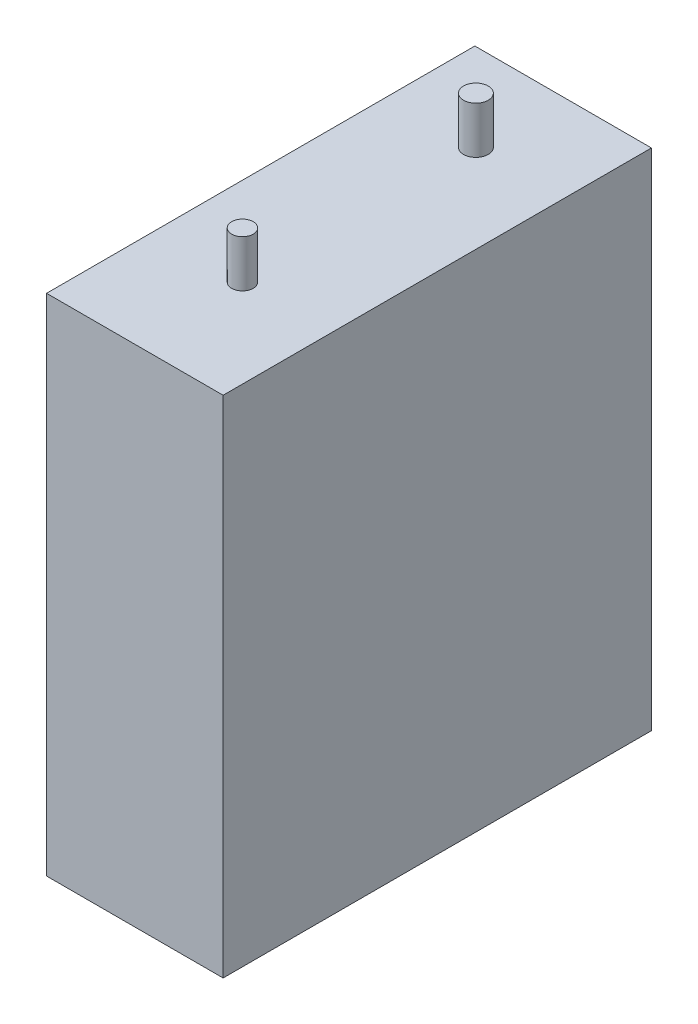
SolidWorks part; units mm, degrees
ref_plane "Front Plane" through (0, 0, 0) normal (0, 0, 1) x (1, 0, 0)
ref_plane "Top Plane" through (0, 0, 0) normal (0, 1, 0) x (1, 0, 0)
ref_plane "Right Plane" through (0, 0, 0) normal (1, 0, 0) x (0, 0, -1)
sketch "Sketch1" plane through (0, 0, 0) normal (1, 0, 0) x (0, 0, -1)
  line L1 (-86.868, -102.362) -> (86.868, -102.362)
  line L2 (-86.868, -102.362) -> (-86.868, 102.362)
  line L3 (-86.868, 102.362) -> (86.868, 102.362)
  line L4 (86.868, -102.362) -> (86.868, 102.362)
  line L5 (-86.868, -102.362) -> (86.868, 102.362) construction
  line L6 (-86.868, 102.362) -> (86.868, -102.362) construction
  point P0 (0, 0)
  dimension "D1" = 204.724
  dimension "D2" = 173.736
extrude "Boss-Extrude1" add sketch "Sketch1" along normal mid plane 71.628
sketch "Sketch2" plane through (0, 102.362, 0) normal (0, 1, 0) x (1, 0, 0)
  circle A0 centre (0, 51.4736) radius 5.0054
  circle A1 centre (0, -43.2184) radius 4.3771
extrude "Boss-Extrude2" add sketch "Sketch2" along normal blind 19.05
